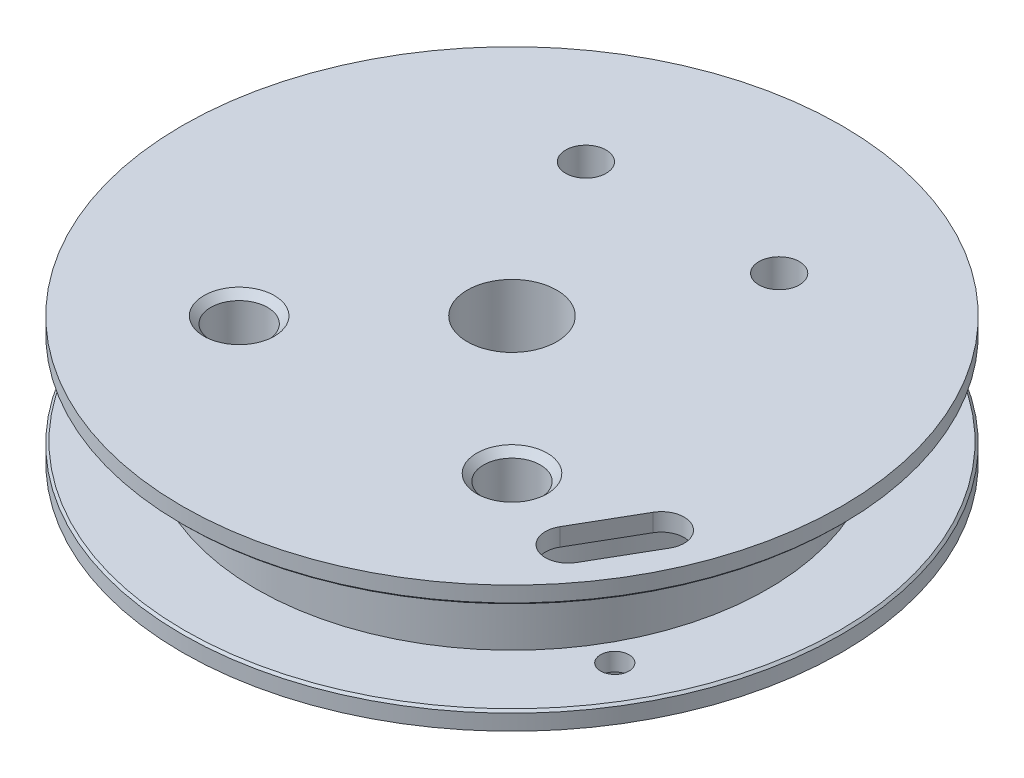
SolidWorks part; units mm, degrees
ref_plane "Front Plane" through (0, 0, 0) normal (0, 0, 1) x (1, 0, 0)
ref_plane "Top Plane" through (0, 0, 0) normal (0, 1, 0) x (1, 0, 0)
ref_plane "Right Plane" through (0, 0, 0) normal (1, 0, 0) x (0, 0, -1)
sketch "Sketch1" plane through (0, 0, 0) normal (0, 0, 1) x (1, 0, 0)
  line L0 (0, 0) -> (0, 83.8274) construction
  line L1 (-2.5, 22.994) -> (-9.525, 22.994)
  line L2 (-9.525, 22.994) -> (-9.525, 28.994)
  line L3 (-9.525, 28.994) -> (-18.415, 28.994)
  line L4 (-18.415, 28.994) -> (-18.415, 29.994)
  line L5 (-18.415, 29.994) -> (-14.2875, 29.994)
  line L6 (-14.2875, 29.994) -> (-14.2875, 35.074)
  line L7 (-14.2875, 35.074) -> (-2.5, 35.074) construction
  line L8 (-14.2875, 35.074) -> (-18.415, 35.074)
  line L9 (-2.5, 35.074) -> (-2.5, 22.994)
  line L10 (-18.415, 35.074) -> (-18.415, 36.0646)
  line L11 (-18.415, 36.0646) -> (-2.5, 36.0646)
  line L12 (-2.5, 36.0646) -> (-2.5, 35.074)
  dimension "D1" = 18.415
  dimension "D2" = 5.08
  dimension "D3" = 1
  dimension "D4" = 6
  dimension "D5" = 2.5
  dimension "D6" = 9.525
  dimension "D7" = 14.2875
  dimension "D8" = 0.9906
  dimension "D9" = 18.415
revolve "Revolve1" add sketch "Sketch1" angle 360 about L0
sketch "Sketch7" plane through (0, 29.994, 0) normal (0, 1, 0) x (1, 0, 0)
  line L0 (0, 0) -> (23.0958, 0) construction
  line L1 (0, 0) -> (19.9688, -11.529) construction
  circle A1 centre (0, 0) radius 15.6845 construction
  circle A4 centre (13.5832, -7.8423) radius 0.7938
  dimension "D1" = 30
  dimension "D2" = 31.369
  dimension "D4" = 1.5875
extrude "Cut-Extrude2" cut sketch "Sketch7" against normal blind 2.54 contours A4
sketch "Sketch8" plane through (0, 36.0646, 0) normal (0, 1, 0) x (1, 0, 0)
  line L1 (-26.9486, 0) -> (27.9762, 0) construction
  line L3 (-26.9486, -7.62) -> (27.9762, -7.62) construction
  line L4 (0, 11.7169) -> (0, -23.0173) construction
  circle A0 centre (7.62, -7.62) radius 1.5748
  circle A1 centre (-7.62, -7.62) radius 1.5748
  dimension "D3" = 3.1496
  dimension "D4" = 3.1496
  dimension "D1" = 7.62
  dimension "D2" = 7.62
  dimension "D5" = 7.62
hole_wizard "1/8 (0.125) Diameter Hole1" positions "Sketch10" profile "Sketch9" hole size "1/8" standard "ANSI Inch"
sketch "Sketch10" plane through (0, 36.0646, 0) normal (0, 1, 0) x (1, 0, 0)
  point P0 (-7.62, -7.62)
  point P3 (7.62, -7.62)
sketch "Sketch9" plane through (-7.62, 36.0646, 7.62) normal (1, 0, 0) x (0, 0, 1)
  line L0 (0, 0) -> (0, 6.0339)
  line L1 (0, 6.0339) -> (1.5875, 5.08)
  line L2 (1.5875, 5.08) -> (1.5875, 0)
  line L5 (1.5875, 0) -> (0, 0)
  line L10 (0, 6.0339) -> (-1.5875, 5.08) construction
  line L11 (0, -6.35) -> (0, 107.95) construction
  dimension "Hole Dia." = 3.175
  dimension "Hole Depth" = 5.08
  dimension "Drill Angle" = 118
sketch "Sketch11" plane through (0, 36.0646, 0) normal (0, 1, 0) x (1, 0, 0)
  line L0 (-23.3463, 9.525) -> (25.6827, 9.525) construction
  line L3 (0, 0) -> (25.6827, 0) construction
  line L4 (0, 0) -> (0, 27.381) construction
  circle A0 centre (-5.3975, 9.525) radius 0.5186
  circle A1 centre (5.3975, 9.525) radius 0.4714
  dimension "D1" = 9.525
  dimension "D2" = 5.3975
  dimension "D3" = 5.3975
  dimension "D4" = 10.795
hole_wizard "#4-40 Tapped Hole1" positions "Sketch13" profile "Sketch12" tap size "#4-40" standard "ANSI Inch"
sketch "Sketch13" plane through (0, 36.0646, 0) normal (0, 1, 0) x (1, 0, 0)
  point P0 (5.3975, 9.525)
  point P3 (-5.3975, 9.525)
sketch "Sketch12" plane through (5.3975, 36.0646, -9.525) normal (1, 0, 0) x (0, 0, 1)
  line L0 (0, 0) -> (0, 6.3942)
  line L1 (0, 6.3942) -> (1.1303, 5.715)
  line L2 (1.1303, 5.715) -> (1.1303, 0)
  line L5 (1.1303, 0) -> (0, 0)
  line L10 (0, 6.3942) -> (-1.1303, 5.715) construction
  line L11 (0, -6.35) -> (0, 107.95) construction
  dimension "Tap Drill Dia." = 2.2606
  dimension "Tap Drill Depth" = 5.715
  dimension "Drill Angle" = 118
sketch "Sketch14" plane through (0, 36.0646, 0) normal (0, 1, 0) x (1, 0, 0)
  line L0 (0, 0) -> (20.2887, -11.7137) construction
  line L1 (0, 0) -> (22.9589, 0) construction
  line L2 (13.5832, -7.8423) -> (22.7619, 8.0557) construction
  line L3 (20.172, 3.57) -> (13.5832, -7.8423) construction
  line L4 (13.5832, -7.8423) -> (4.6877, -23.2497) construction
  line L5 (14.5357, -6.1925) -> (12.6307, -9.492) construction
  line L6 (15.6355, -6.8275) -> (13.7305, -10.127)
  line L7 (13.4358, -5.5575) -> (11.5308, -8.857)
  circle A0 centre (0, 0) radius 15.6845 construction
  circle A1 centre (13.5832, -7.8423) radius 1.5875 construction
  arc A2 (15.6355, -6.8275) -> (13.4358, -5.5575) centre (14.5357, -6.1925) ccw
  arc A3 (11.5308, -8.857) -> (13.7305, -10.127) centre (12.6307, -9.492) ccw
  point P12 (13.5832, -7.8423)
  dimension "D2" = 31.369
  dimension "D3" = 1.905
  dimension "D1" = 30
  dimension "D4" = 90
  dimension "D5" = 2.54
  dimension "D6" = 1.905
extrude "Cut-Extrude4" cut sketch "Sketch14" against normal up to next
chamfer "Chamfer1" distance 0.127 angle 45 2 edges at (0, 35.074, -18.415) (0, 29.994, -18.415)
chamfer "Chamfer2" distance 0.381 angle 45 2 edges at (7.62, 36.0646, 9.2075) (-7.62, 36.0646, 9.2075)
sketch "Sketch16" plane through (0, 0, 0) normal (0, 1, 0) x (1, 0, 0)
  line L0 (13.5832, -7.8423) -> (0, 0) construction
  line L2 (0, 0) -> (15.4584, 33.1508)
  dimension "D1" = 95
ref_plane "Plane3" through (0, 0, 0) normal (0.9063, 0, 0.4226) x (0.4226, 0, -0.9063)
sketch "Sketch2" plane through (0, 0, 0) normal (0, 0, 1) x (1, 0, 0)
  line L0 (-9.525, 22.994) -> (9.525, 22.994) construction
  circle A0 centre (0, 25.994) radius 0.635
  dimension "D1" = 3
  dimension "D2" = 1.27
extrude "Cut-Extrude1" cut sketch "Sketch2" along normal up to next contours A0
hole_wizard "#10-32 Tapped Hole1" positions "Sketch20" profile "Sketch19" tap size "#10-32" standard "ANSI Inch"
sketch "Sketch20" plane through (0, 0, 0) normal (0, 0, 1) x (1, 0, 0)
  point P0 (0, 25.994)
sketch "Sketch19" plane through (0, 25.994, 0) normal (1, 0, 0) x (0, 1, 0)
  line L0 (0, 0) -> (0, 18.415)
  line L1 (0, 18.415) -> (2.0193, 18.415)
  line L2 (2.0193, 18.415) -> (2.0193, 0)
  line L5 (2.0193, 0) -> (0, 0)
  line L11 (0, -6.35) -> (0, 107.95) construction
  dimension "Thru Tap Drill Dia." = 4.0386
  dimension "Thru Tap Drill Depth" = 18.415
